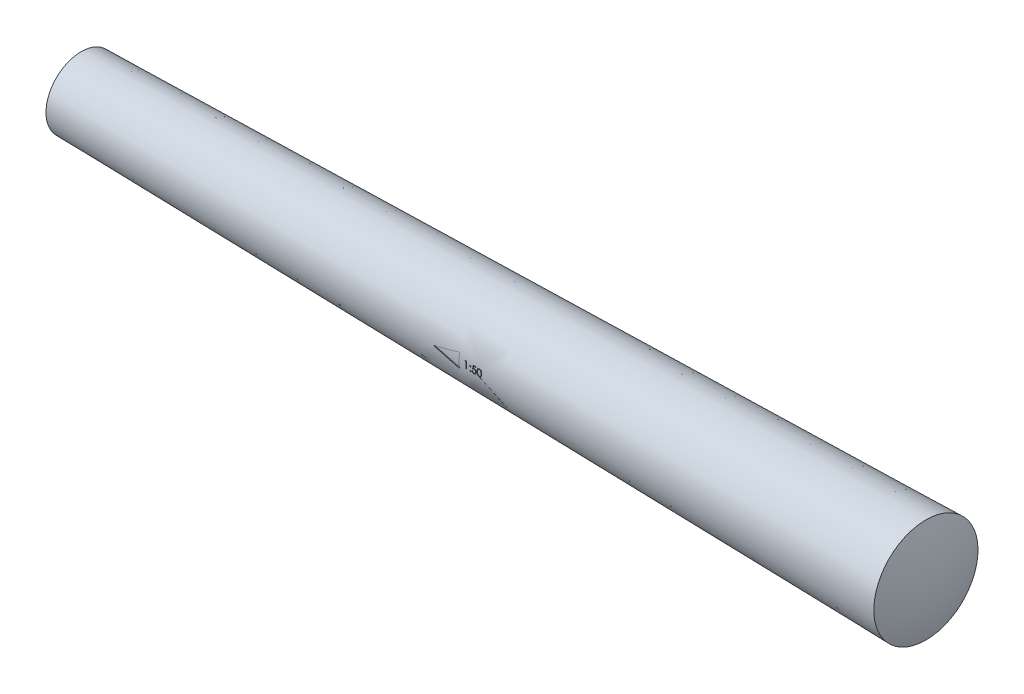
SolidWorks part; units mm, degrees
ref_plane "Front Plane" through (0, 0, 0) normal (0, 0, 1) x (1, 0, 0)
ref_plane "Top Plane" through (0, 0, 0) normal (0, 1, 0) x (1, 0, 0)
ref_plane "Right Plane" through (0, 0, 0) normal (1, 0, 0) x (0, 0, -1)
sketch "Sketch1" plane through (0, 0, 0) normal (1, 0, 0) x (0, 0, -1)
  circle A0 centre (0, 0) radius 5
  dimension "D1" = 10
extrude "Extrude1" add sketch "Sketch1" along normal mid plane 120
draft "Draft1" type of draft neutral plane draft angle 1.146 faces to draft 1 parameters "D1"=1.146
sketch "Sketch2" plane through (0, 0, 0) normal (0, 0, 1) x (1, 0, 0)
  line L0 (-60, 0) -> (-60, 5)
  line L1 (-60, 5) -> (-60, -5) construction
  line L2 (-60, 0) -> (-61.2, 0)
  line L3 (-61.2, 0) -> (-61.2, -6.2) construction
  line L4 (60, 0) -> (60, 7.4001)
  line L5 (60, -7.4001) -> (60, 7.4001) construction
  line L6 (60, 0) -> (61.2, 0)
  line L7 (61.2, 0) -> (61.2, -6.2) construction
  line L8 (-60, -5) -> (60, -7.4001) construction
  arc A0 (-61.2, 0) -> (-60, 5) centre (-50.1833, 0) cw
  arc A1 (61.2, 0) -> (60, 7.4001) centre (37.7829, 0) ccw
  point P14 (0, -6.2)
revolve "Revolve1" add sketch "Sketch2" angle 360 about L2
sketch "Sketch5" plane through (0, 0, 0) normal (0, 0, 1) x (1, 0, 0)
  line L0 (0, 6.2) -> (0, -6.2) construction
  line L1 (60, 7.4001) -> (-60, 5) construction
  line L2 (-60, -5) -> (60, -7.4001) construction
ref_plane "Plane2" through (0, 0, 0) normal (-0.02, 0, 0.9998) x (0.9998, 0, 0.02)
sketch "Sketch6" plane through (0, 0, 0) normal (-0.02, 0, 0.9998) x (0.9998, 0, 0.02)
  line L0 (0, 0) -> (0, 1)
  line L1 (0, 6.2) -> (0, -6.2) construction
  line L2 (0, 1) -> (-3.7321, 0)
  line L3 (-3.7321, 0) -> (0, -1)
  line L4 (0, -1) -> (0, 0)
  line L5 (0, -0.5) -> (4, -0.5) construction
  text T0 "1:50" font "Century Gothic" height 1
  dimension "D1" = 2
  dimension "D2" = 30
  dimension "D3" = 4
wrap "Wrap2" sketch "Sketch6" wrap type deboss source sketch "Sketch6" thickness 0.1 parameters "D1"=0.1
equation "\"D2@Sketch2\" = \"D1@Sketch2\""
